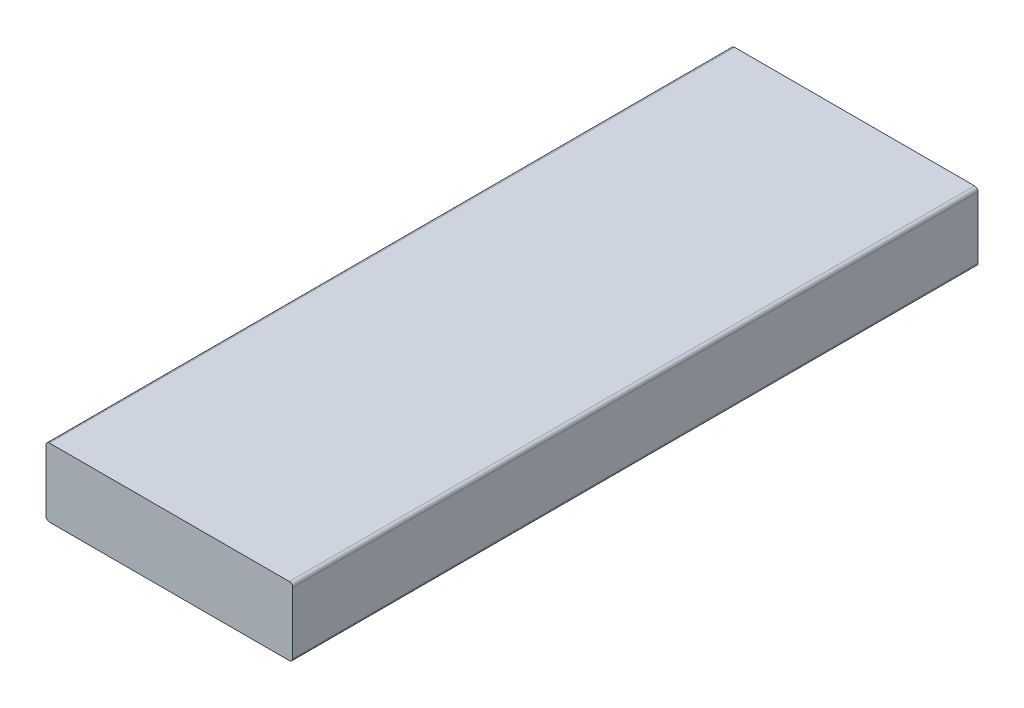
SolidWorks part; units mm, degrees
ref_plane "Alzado" through (0, 0, 0) normal (0, 0, 1) x (1, 0, 0)
ref_plane "Planta" through (0, 0, 0) normal (0, 1, 0) x (1, 0, 0)
ref_plane "Vista lateral" through (0, 0, 0) normal (1, 0, 0) x (0, 0, -1)
sketch "Sketch1" plane through (0, 0, 0) normal (0, 0, 1) x (1, 0, 0)
  line L1 (-10.8, -3) -> (10.8, -3)
  line L2 (-10.8, -3) -> (-10.8, 3)
  line L3 (-10.8, 3) -> (10.8, 3)
  line L4 (10.8, -3) -> (10.8, 3)
  line L5 (-10.8, -3) -> (10.8, 3) construction
  line L6 (-10.8, 3) -> (10.8, -3) construction
  point P0 (0, 0)
  dimension "D1" = 21.6
  dimension "D2" = 6
extrude "Boss-Extrude1" add sketch "Sketch1" along normal blind 60
fillet "Fillet1" radius 0.3 4 edges at (10.8, 3, 30) (10.8, -3, 30) (-10.8, -3, 30) (-10.8, 3, 30)
